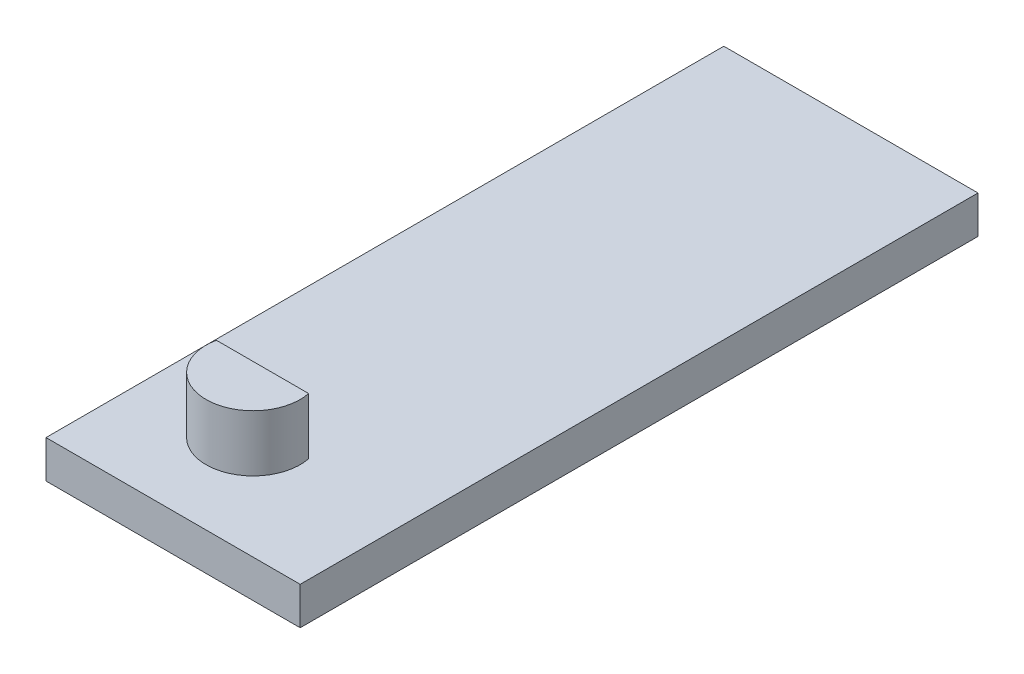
SolidWorks part; units mm, degrees
ref_plane "Face" through (0, 0, 0) normal (0, 0, 1) x (1, 0, 0)
ref_plane "Dessus" through (0, 0, 0) normal (0, 1, 0) x (1, 0, 0)
ref_plane "Droite" through (0, 0, 0) normal (1, 0, 0) x (0, 0, -1)
sketch "Esquisse1" plane through (0, 0, 0) normal (0, 1, 0) x (1, 0, 0)
  line L1 (0, 0) -> (27, 0)
  line L2 (0, 0) -> (0, 36)
  line L3 (0, 36) -> (27, 36)
  line L4 (27, 0) -> (27, 36)
  dimension "D1" = 36
  dimension "D2" = 27
extrude "Extrusion1" add sketch "Esquisse1" along normal blind 2
sketch "Esquisse2" plane through (0, 2, 0) normal (0, 1, 0) x (-1, 0, 0)
  line L2 (-23.9495, -6) -> (-19.0505, -6)
  line L3 (-27, 0) -> (-27, -36) construction
  line L4 (0, 0) -> (-27, 0) construction
  line L5 (-7.9495, -6) -> (-3.0505, -6)
  line L6 (0, -36) -> (0, 0) construction
  arc A0 (-7.9495, -6) -> (-3.0505, -6) centre (-5.5, -5.5) cw
  arc A1 (-23.9495, -6) -> (-19.0505, -6) centre (-21.5, -5.5) cw
  dimension "D1" = 5.5
  dimension "D3" = 2.5
  dimension "D2" = 5.5
  dimension "D4" = 5.5
extrude "Extrusion2" add sketch "Esquisse2" along normal blind 3
sketch "Esquisse3" plane through (0, 2, 0) normal (0, 1, 0) x (-1, 0, 0)
  line L1 (-27, -36) -> (-13.5, -36)
  line L2 (-27, -36) -> (-27, 0)
  line L3 (-27, 0) -> (-13.5, 0)
  line L4 (-13.5, -36) -> (-13.5, 0)
  dimension "D1" = 13.5
extrude "Enlèv. mat.-Extru.1" cut sketch "Esquisse3" against normal through all and the other way through all
